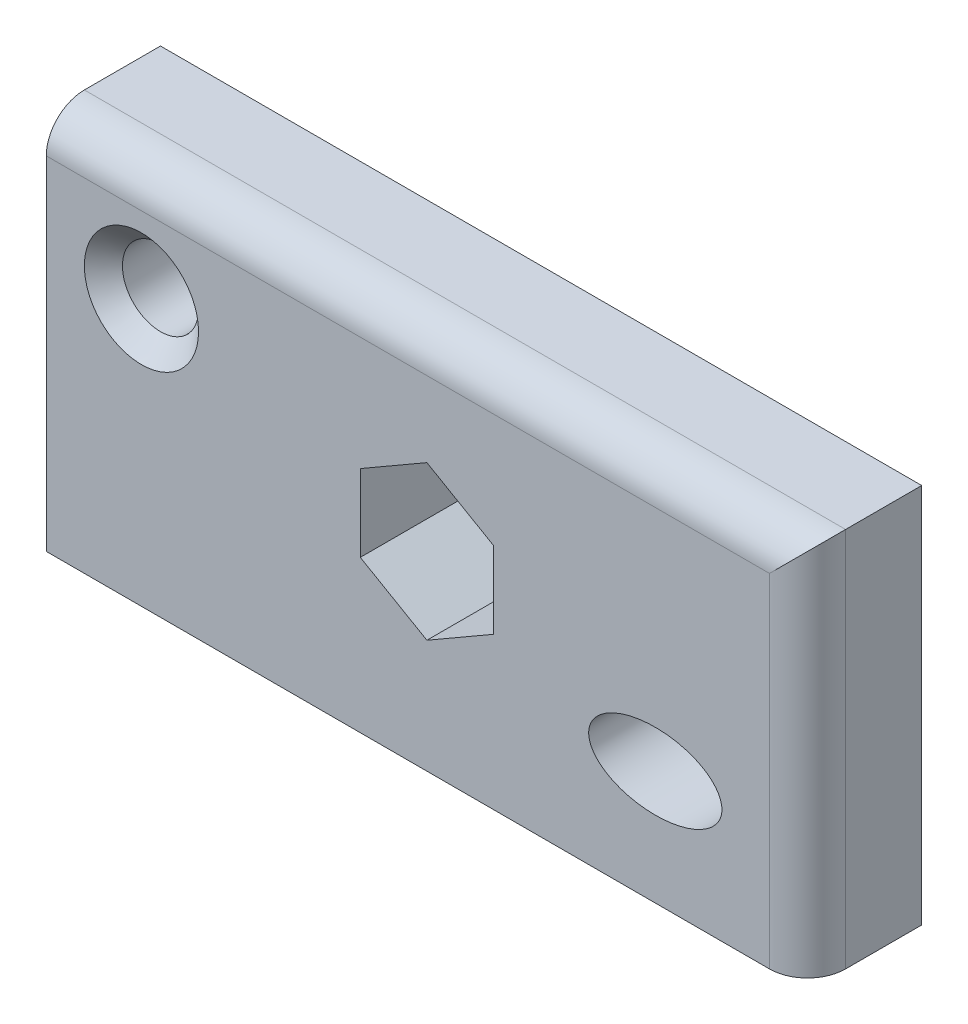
SolidWorks part; units mm, degrees
ref_plane "Płaszczyzna przednia" through (0, 0, 0) normal (0, 0, 1) x (1, 0, 0)
ref_plane "Płaszczyzna górna" through (0, 0, 0) normal (0, 1, 0) x (1, 0, 0)
ref_plane "Płaszczyzna prawa" through (0, 0, 0) normal (1, 0, 0) x (0, 0, -1)
sketch "Szkic1" plane through (0, 0, 0) normal (0, 0, 1) x (1, 0, 0)
  line L1 (100, -50) -> (-100, -50)
  line L2 (100, -50) -> (100, 50)
  line L3 (100, 50) -> (-100, 50)
  line L4 (-100, -50) -> (-100, 50)
  line L5 (100, -50) -> (-100, 50) construction
  line L6 (100, 50) -> (-100, -50) construction
  point P0 (0, 0)
  dimension "D1" = 100
  dimension "D2" = 200
extrude "Dodanie-wyciągnięcie1" add sketch "Szkic1" along normal blind 30
sketch "Szkic2" plane through (0, 0, 30) normal (0, 0, 1) x (1, 0, 0)
  line L0 (-100, 50) -> (-100, -50) construction
  line L1 (100, 50) -> (-100, 50) construction
  circle A0 centre (-75, 20) radius 10
  dimension "D1" = 20
  dimension "D3" = 30
  dimension "D2" = 25
extrude "Wytnij-wyciągnięcie1" cut sketch "Szkic2" against normal through all
sketch "Szkic3" plane through (0, 0, 30) normal (0, 0, 1) x (1, 0, 0)
  line L1 (-17.5, 10.1036) -> (-17.5, -10.1036)
  line L2 (-17.5, -10.1036) -> (0, -20.2073)
  line L3 (0, -20.2073) -> (17.5, -10.1036)
  line L4 (17.5, -10.1036) -> (17.5, 10.1036)
  line L5 (17.5, 10.1036) -> (0, 20.2073)
  line L6 (0, 20.2073) -> (-17.5, 10.1036)
  circle A0 centre (0, 0) radius 17.5 construction
  dimension "D1" = 35
extrude "Wytnij-wyciągnięcie2" cut sketch "Szkic3" against normal through all
sketch "Szkic4" plane through (0, 0, 30) normal (0, 0, 1) x (1, 0, 0)
  line L0 (100, -50) -> (100, 50) construction
  line L1 (-100, -50) -> (100, -50) construction
  ellipse E0 centre (60, -20) end of major axis (77.5, -20) minor radius 10
  point P1 (0, 0)
  dimension "D1" = 35
  dimension "D2" = 20
  dimension "D3" = 40
  dimension "D4" = 30
extrude "Wytnij-wyciągnięcie3" cut sketch "Szkic4" against normal through all
fillet "Zaokrąglenie1" radius 10 2 edges at (100, 0, 30) (0, 50, 30)
chamfer "Sfazowanie1" distance 5 angle 45 1 edges at (-65, 20, 30)
